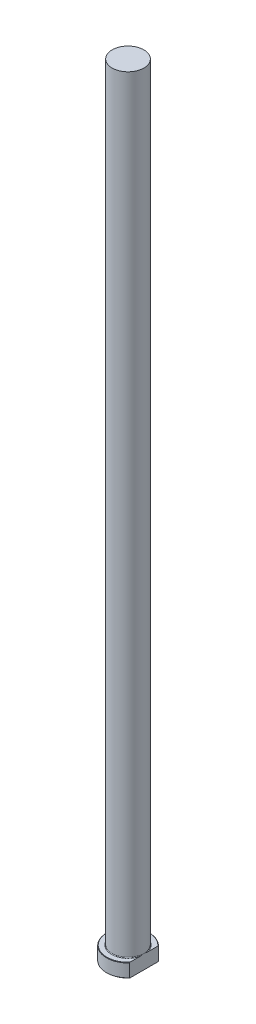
SolidWorks part; units mm, degrees
ref_plane "Front Plane" through (0, 0, 0) normal (0, 0, 1) x (1, 0, 0)
ref_plane "Top Plane" through (0, 0, 0) normal (0, 1, 0) x (1, 0, 0)
ref_plane "Right Plane" through (0, 0, 0) normal (1, 0, 0) x (0, 0, -1)
sketch "Sketch1" plane through (0, 0, 0) normal (0, 0, 1) x (1, 0, 0)
  line L0 (0, 259.9588) -> (0, -15.1925) construction
  line L1 (0, 0) -> (-11, 0)
  line L2 (-11, 0) -> (-11, 7)
  line L3 (-11, 7) -> (-8.1, 7)
  line L4 (-8.1, 7) -> (-8.1, 400)
  line L5 (-8.1, 400) -> (0, 400)
  line L6 (0, 400) -> (0, 0)
  dimension "L" = 400
  dimension "H" = 22
  dimension "T" = 7
  dimension "D" = 16.2
revolve "Revolve1" add sketch "Sketch1" angle 360 about L0
chamfer "Chamfer1" distance 0.2 angle 45 2 edges at (0, 7, 11) (0, 0, 11)
fillet "Fillet1" radius 0.3 1 edges at (0, 7, 8.1)
sketch "Sketch2" plane through (0, 0, 0) normal (0, 1, 0) x (1, 0, 0)
  line L0 (8.1, 7.4424) -> (8.1, -7.4424)
  circle A0 centre (0, 0) radius 11 construction
  arc A1 (8.1, -7.4424) -> (8.1, 7.4424) centre (0, 0) ccw
  circle A2 centre (0, 0) radius 8.1 construction
extrude "KEY" cut sketch "Sketch2" along normal through all
